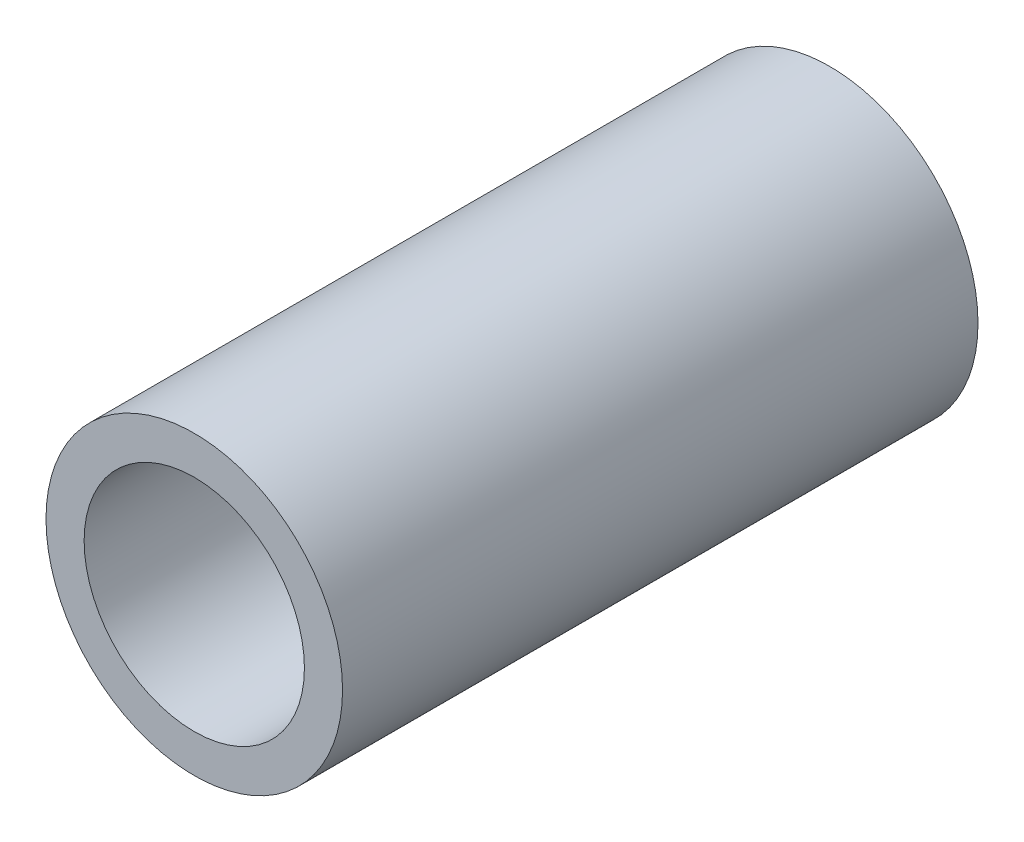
SolidWorks part; units mm, degrees
ref_plane "前视基准面" through (0, 0, 0) normal (0, 0, 1) x (1, 0, 0)
ref_plane "上视基准面" through (0, 0, 0) normal (0, 1, 0) x (1, 0, 0)
ref_plane "右视基准面" through (0, 0, 0) normal (1, 0, 0) x (0, 0, -1)
sketch "草图1" plane through (0, 0, 0) normal (0, 0, 1) x (1, 0, 0)
  circle A0 centre (0, 0) radius 26
  circle A1 centre (0, 0) radius 35
  dimension "D1" = 70
  dimension "D2" = 52
extrude "拉伸1" add sketch "草图1" along normal blind 150
